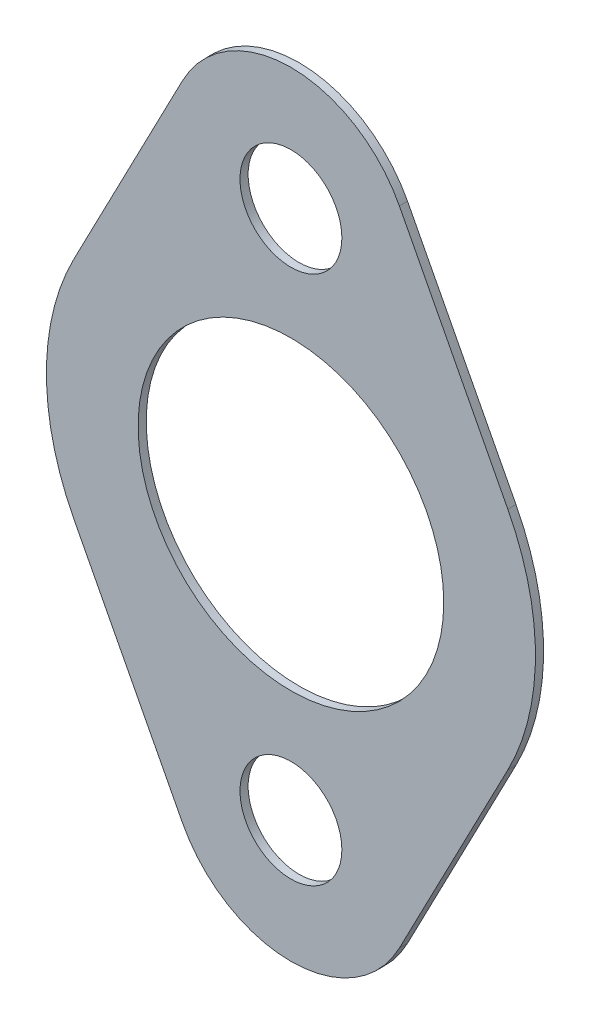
SolidWorks part; units mm, degrees
ref_plane "Front" through (0, 0, 0) normal (0, 0, 1) x (1, 0, 0)
ref_plane "Top" through (0, 0, 0) normal (0, 1, 0) x (1, 0, 0)
ref_plane "Right" through (0, 0, 0) normal (1, 0, 0) x (0, 0, -1)
sketch "Sketch1" plane through (0, 0, 0) normal (0, 0, 1) x (1, 0, 0)
  line L0 (0, 0) -> (0, 94.4945) construction
  line L1 (0, 0) -> (88.837, 0) construction
  line L2 (26.6136, 78.8462) -> (53.2272, 27.6923)
  line L3 (26.6136, -78.8462) -> (53.2272, -27.6923)
  line L4 (-26.6136, 78.8462) -> (-53.2272, 27.6923)
  line L5 (-26.6136, -78.8462) -> (-53.2272, -27.6923)
  arc A0 (-26.6136, 78.8462) -> (26.6136, 78.8462) centre (0, 65) cw
  arc A1 (-26.6136, -78.8462) -> (26.6136, -78.8462) centre (0, -65) ccw
  arc A2 (53.2272, 27.6923) -> (53.2272, -27.6923) centre (0, 0) cw
  arc A3 (-53.2272, -27.6923) -> (-53.2272, 27.6923) centre (0, 0) cw
  dimension "EndR" = 30
  dimension "SideR" = 60
  dimension "CtoC" = 130
extrude "Main" add sketch "Sketch1" along normal blind 2
sketch "Sketch2" plane through (0, 0, 2) normal (0, 0, 1) x (1, 0, 0)
  circle A0 centre (0, 65) radius 12.5
  circle A1 centre (0, -65) radius 12.5
  circle A2 centre (0, 0) radius 37.5
  dimension "BoltH" = 25
  dimension "CenterH" = 75
extrude "Holes" cut sketch "Sketch2" against normal through all
